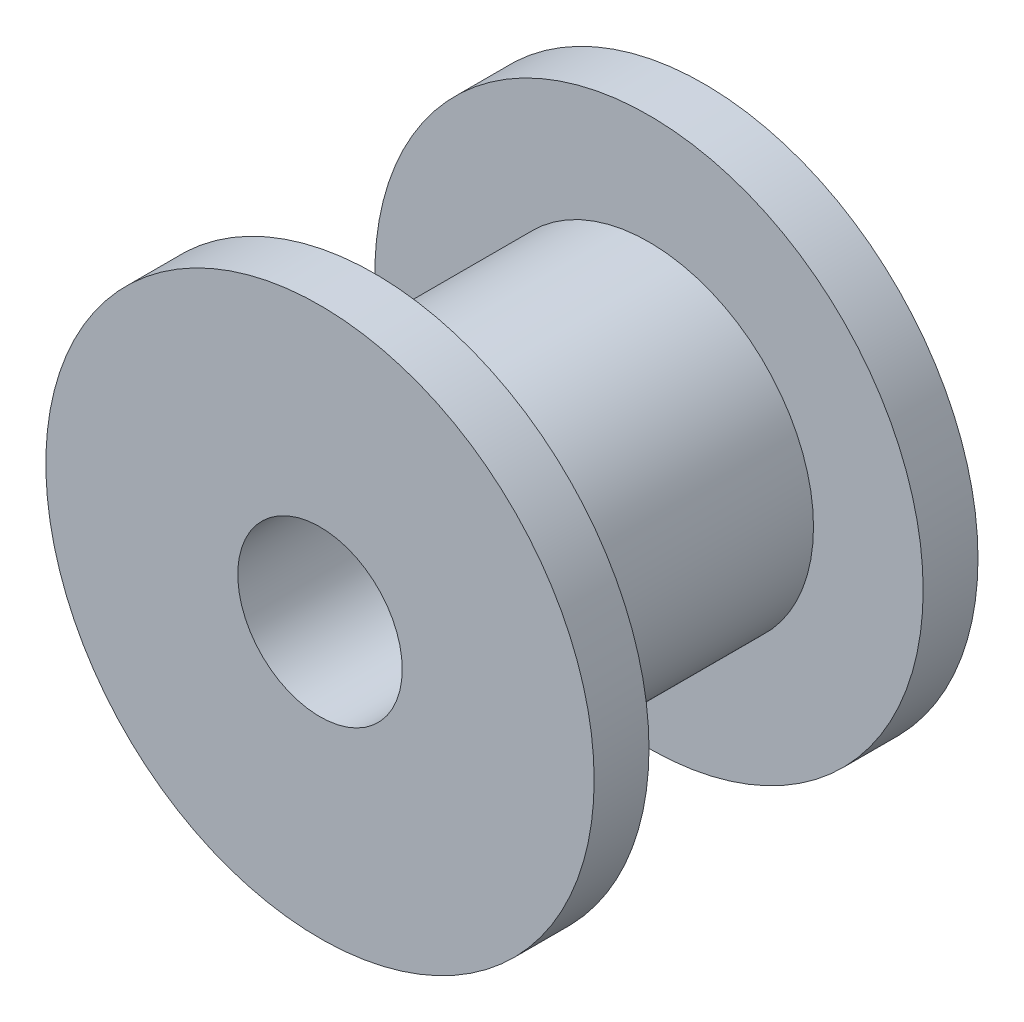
SolidWorks part; units mm, degrees
ref_plane "前视基准面" through (0, 0, 0) normal (0, 0, 1) x (1, 0, 0)
ref_plane "上视基准面" through (0, 0, 0) normal (0, 1, 0) x (1, 0, 0)
ref_plane "右视基准面" through (0, 0, 0) normal (1, 0, 0) x (0, 0, -1)
sketch "草图1" plane through (0, 0, 0) normal (0, 0, 1) x (1, 0, 0)
  circle A0 centre (0, 0) radius 10
  dimension "D1" = 20
extrude "凸台-拉伸1" add sketch "草图1" along normal blind 2
sketch "草图2" plane through (0, 0, 2) normal (0, 0, 1) x (1, 0, 0)
  circle A0 centre (0, 0) radius 6
  dimension "D1" = 12
extrude "凸台-拉伸2" add sketch "草图2" along normal blind 10
sketch "草图3" plane through (0, 0, 12) normal (0, 0, 1) x (1, 0, 0)
  circle A0 centre (0, 0) radius 10
  dimension "D1" = 20
extrude "凸台-拉伸3" add sketch "草图3" along normal blind 2
sketch "草图4" plane through (0, 0, 14) normal (0, 0, 1) x (1, 0, 0)
  circle A0 centre (0, 0) radius 3
  dimension "D1" = 6
extrude "切除-拉伸1" cut sketch "草图4" against normal blind 25
